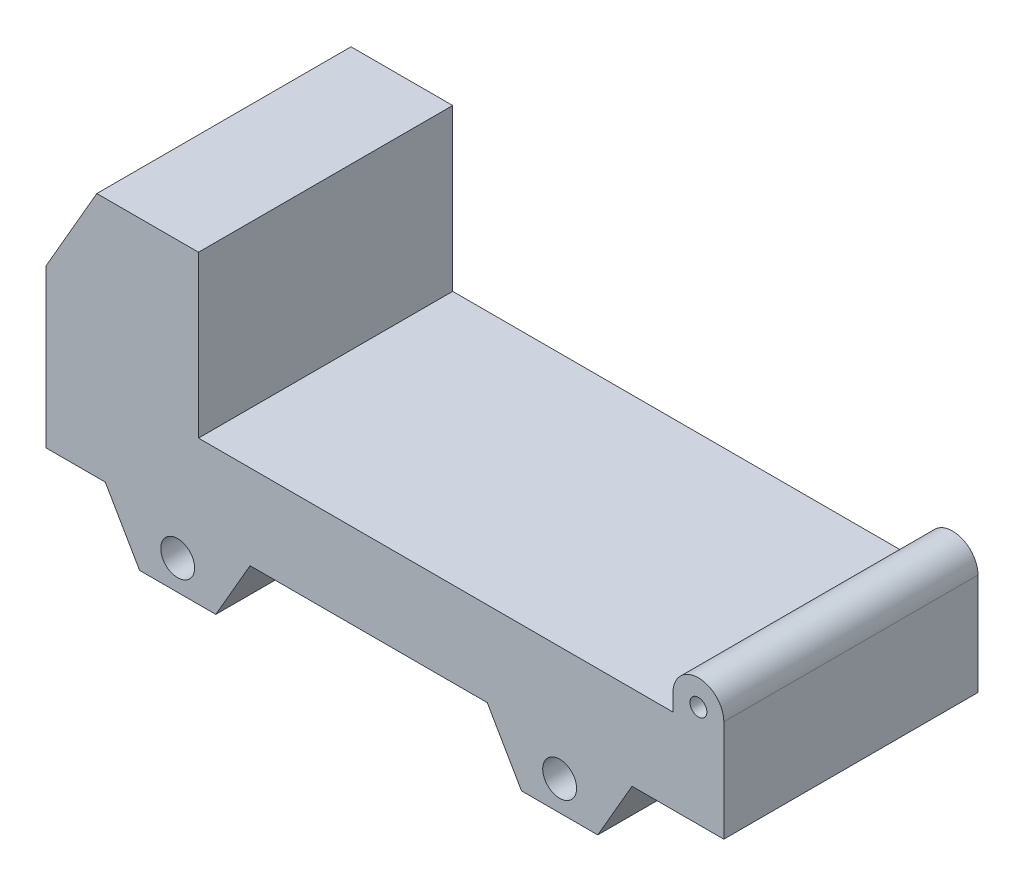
SolidWorks part; units mm, degrees
ref_plane "Plan de face" through (0, 0, 0) normal (0, 0, 1) x (1, 0, 0)
ref_plane "Plan de dessus" through (0, 0, 0) normal (0, 1, 0) x (1, 0, 0)
ref_plane "Plan de droite" through (0, 0, 0) normal (1, 0, 0) x (0, 0, -1)
sketch "Esquisse1" plane through (0, 0, 0) normal (0, 0, 1) x (1, 0, 0)
  line L0 (280, 0) -> (0, 0)
  line L1 (0, 0) -> (0, 95)
  line L2 (0, 95) -> (-60, 95)
  line L3 (-60, 95) -> (-90, 43.0385)
  line L4 (-90, 43.0385) -> (-90, -50)
  line L5 (-90, -50) -> (-55, -50)
  line L6 (-55, -50) -> (-34.7927, -85)
  line L7 (-34.7927, -85) -> (10.2073, -85)
  line L8 (10.2073, -85) -> (30.4145, -50)
  line L9 (30.4145, -50) -> (170.4145, -50)
  line L10 (170.4145, -50) -> (190.6218, -85)
  line L11 (190.6218, -85) -> (235.6218, -85)
  line L12 (235.6218, -85) -> (255.829, -50)
  line L13 (255.829, -50) -> (310, -50)
  line L14 (310, -50) -> (310, 0)
  line L15 (310, 0) -> (310, 10)
  line L16 (280, 10) -> (280, 0)
  arc A0 (310, 10) -> (280, 10) centre (295, 10) ccw
  circle A1 centre (-12.2927, -67.5) radius 10
  circle A2 centre (213.1218, -67.5) radius 10
  circle A3 centre (295, 10) radius 5
  dimension "D3" = 35
  dimension "D14" = 10
  dimension "D16" = 22.5
  dimension "D17" = 17.5
  dimension "D18" = 20
  dimension "D19" = 22.5
  dimension "D21" = 20
  dimension "D22" = 15
  dimension "D23" = 10
  dimension "D1" = 400
  dimension "D2" = 50
  dimension "D4" = 60
  dimension "D5" = 35
  dimension "D6" = 60
  dimension "D7" = 30
  dimension "D8" = 90
  dimension "D9" = 35
  dimension "D10" = 45
  dimension "D11" = 140
  dimension "D12" = 60
  dimension "D13" = 95
  dimension "D15" = 50
  dimension "D20" = 17.5
extrude "Boss.-Extru.1" add sketch "Esquisse1" along normal blind 150 contours A1 | A3 | L4 L5 L6 L7 L8 L9 L10 L11 L12 L13 L14 L15 A0 L16 L0 L1 L2 L3 | A2
